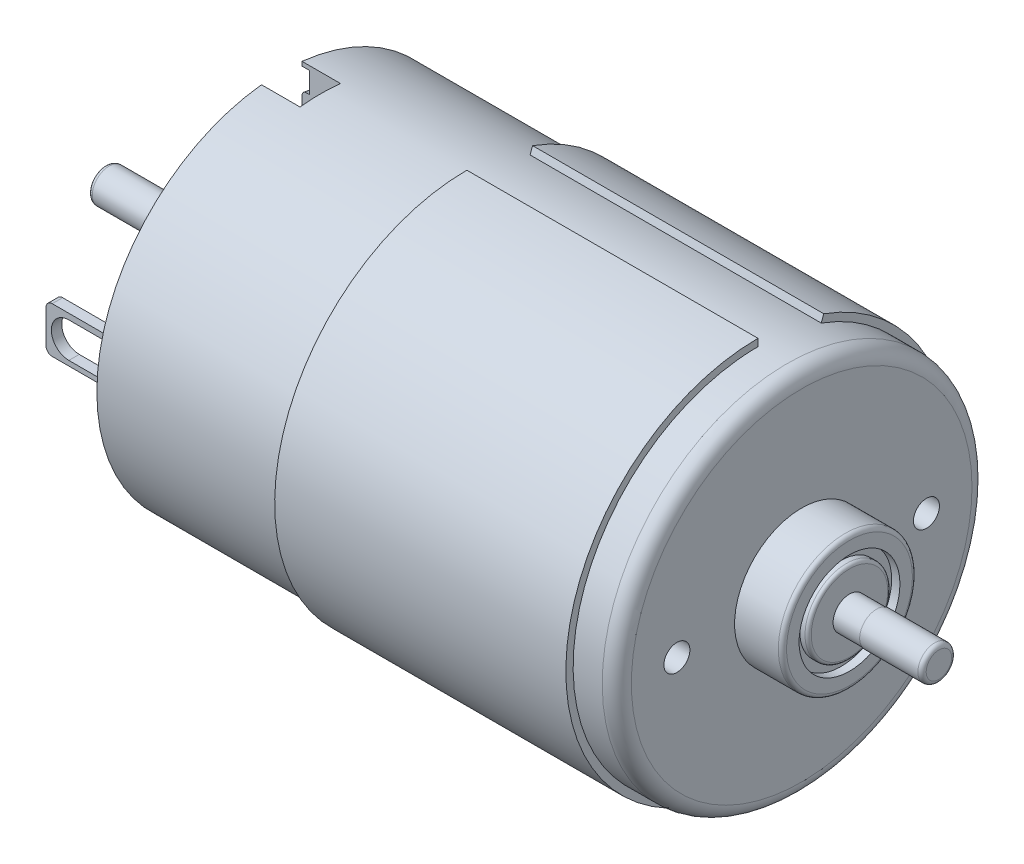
SolidWorks part; units mm, degrees
ref_plane "Front Plane" through (0, 0, 0) normal (0, 0, 1) x (1, 0, 0)
ref_plane "Top Plane" through (0, 0, 0) normal (0, 1, 0) x (1, 0, 0)
ref_plane "Right Plane" through (0, 0, 0) normal (1, 0, 0) x (0, 0, -1)
sketch "Sketch1" plane through (0, 0, 0) normal (1, 0, 0) x (0, 0, -1)
  circle A0 centre (0, 0) radius 17.78
extrude "Extrude1" add sketch "Sketch1" along normal blind 50
sketch "Sketch2" plane through (50, 0, 0) normal (1, 0, 0) x (0, 0, -1)
  circle A0 centre (0, 0) radius 6.45
extrude "Extrude2" add sketch "Sketch2" along normal blind 4.6
sketch "Sketch3" plane through (54.6, 0, 0) normal (1, 0, 0) x (0, 0, -1)
  circle A0 centre (0, 0) radius 1.58
extrude "Extrude3" add sketch "Sketch3" along normal blind 2.6
fillet "Fillet1" radius 1.4 1 edges at (50, 0, -17.78)
sketch "Sketch4" plane through (0, 0, 0) normal (-1, 0, 0) x (0, 0, 1)
  circle A0 centre (0, 0) radius 6.475
extrude "Extrude4" add sketch "Sketch4" along normal blind 3
sketch "Sketch5" plane through (-3, 0, 0) normal (-1, 0, 0) x (0, 0, 1)
  circle A0 centre (0, 0) radius 3.95
  circle A1 centre (0, 0) radius 2.9
extrude "Extrude5" add sketch "Sketch5" along normal blind 1
chamfer "Chamfer1" distance 0.8 angle 45 1 edges at (-4, 0, 3.95)
sketch "Sketch6" plane through (-3, 0, 0) normal (-1, 0, 0) x (0, 0, 1)
  circle A0 centre (0, 0) radius 1.58
extrude "Extrude6" add sketch "Sketch6" along normal blind 8
sketch "Sketch7" plane through (54.6, 0, 0) normal (1, 0, 0) x (0, 0, -1)
  circle A0 centre (0, 0) radius 4.85
  circle A1 centre (0, 0) radius 3.98
extrude "Extrude7" cut sketch "Sketch7" against normal blind 0.8
fillet "Fillet2" radius 0.3 1 edges at (54.6, 0, -3.98)
fillet "Fillet3" radius 0.4 1 edges at (54.6, 0, -6.45)
sketch "Sketch8" plane through (0, 0, 0) normal (-1, 0, 0) x (0, 0, 1)
  line L1 (0, 15.38) -> (0, -15.38) construction
  line L2 (-8.972, -12.4919) -> (8.972, -12.4919)
  line L3 (-8.972, -12.4919) -> (-8.972, 12.4919)
  line L4 (-8.972, 12.4919) -> (8.972, 12.4919)
  line L5 (8.972, -12.4919) -> (8.972, 12.4919)
  line L6 (-8.972, -12.4919) -> (8.972, 12.4919) construction
  line L7 (-8.972, 12.4919) -> (8.972, -12.4919) construction
  circle A0 centre (0, 0) radius 17.38
  circle A1 centre (0, 0) radius 15.38
  circle A2 centre (0, 0) radius 17.78 construction
  dimension "D1" = 17.9439
  dimension "D2" = 2
  dimension "D3" = 0.4
extrude "Extrude9" cut sketch "Sketch8" against normal blind 0.7 contours L3 A1 | A0 A1 | L5 A1
fillet "Fillet4" radius 0.4 5 edges at (0, 0, -6.475) (0, 0, 8.972) (0, 15.38, 0) (0, -15.38, 0) (0, 0, -8.972)
sketch "Sketch11" plane through (0, 0, 0) normal (-1, 0, 0) x (0, 0, 1)
  line L0 (0, -20.3904) -> (0, 28.4689) construction
  line L1 (-2.95, 19.0412) -> (2.95, 19.0412)
  line L2 (-2.95, 19.0412) -> (-2.95, 13.1401)
  line L3 (-2.95, 13.1401) -> (2.95, 13.1401)
  line L4 (2.95, 19.0412) -> (2.95, 13.1401)
  line L5 (-1.95, -13.7401) -> (1.95, -18.8623) construction
  line L6 (-21.1725, 0) -> (23.0165, 0) construction
  line L7 (-3.0332, -17.5194) -> (3.0332, -17.5194)
  line L8 (2.95, -19.0412) -> (2.95, -13.1401)
  line L9 (-2.95, -13.1401) -> (2.95, -13.1401)
  line L10 (-2.95, -19.0412) -> (-2.95, -13.1401)
  line L11 (-2.95, -19.0412) -> (2.95, -19.0412)
  line L12 (-1.95, 18.8623) -> (1.95, 18.8623)
  line L13 (-1.95, 18.8623) -> (-1.95, 13.7401)
  line L14 (-1.95, 13.7401) -> (1.95, 13.7401)
  line L15 (1.95, 18.8623) -> (1.95, 13.7401)
  line L16 (-1.95, 18.8623) -> (1.95, 13.7401) construction
  line L17 (-1.95, 13.7401) -> (1.95, 18.8623) construction
  line L18 (-1.95, -18.8623) -> (1.95, -13.7401) construction
  line L19 (0, 20.3904) -> (0, -28.4689) construction
  line L20 (1.95, -18.8623) -> (1.95, -13.7401)
  line L21 (-1.95, -13.7401) -> (1.95, -13.7401)
  line L22 (-1.95, -18.8623) -> (-1.95, -13.7401)
  line L23 (-1.95, -18.8623) -> (1.95, -18.8623)
  line L24 (2.95, -19.0412) -> (2.95, -13.1401)
  line L25 (-2.95, -13.1401) -> (2.95, -13.1401)
  line L26 (-2.95, -19.0412) -> (-2.95, -13.1401)
  line L27 (-2.95, -19.0412) -> (2.95, -19.0412)
  point P7 (0, 16.3012)
  point P27 (0, -16.3012)
  dimension "D1" = 5.9
  dimension "D2" = 2.95
  dimension "D3" = 1
  dimension "D4" = 0.6
extrude "Extrude11" cut sketch "Sketch11" against normal blind 3.7 contours L15 L12 L13 M4 | L15 L13 L14 M4 | L22 L7 L20 M2 | L22 L20 L21 M2 | L22 L23 L20 L7
sketch "Sketch13" plane through (0.7, 0, 0) normal (-1, 0, 0) x (0, 0, 1)
  line L0 (25.4225, 0) -> (-19.8791, 0) construction
  line L1 (11.2225, -5.97) -> (16.3225, -5.97)
  line L2 (11.2225, -5.97) -> (11.2225, 5.97)
  line L3 (11.2225, 5.97) -> (16.3225, 5.97)
  line L4 (16.3225, -5.97) -> (16.3225, 5.97)
  line L5 (11.2225, -5.97) -> (16.3225, 5.97) construction
  line L6 (11.2225, 5.97) -> (16.3225, -5.97) construction
  line L7 (11.9725, 5) -> (15.5725, 5)
  line L8 (11.9725, 5) -> (11.9725, -5)
  line L9 (11.9725, -5) -> (15.5725, -5)
  line L10 (15.5725, 5) -> (15.5725, -5)
  line L11 (11.9725, 5) -> (15.5725, -5) construction
  line L12 (11.9725, -5) -> (15.5725, 5) construction
  line L13 (0, 20.1635) -> (0, -20.37) construction
  line L14 (-11.9725, -5) -> (-15.5725, 5) construction
  line L15 (-11.9725, 5) -> (-15.5725, -5) construction
  line L16 (-11.2225, 5.97) -> (-16.3225, -5.97) construction
  line L17 (-11.2225, -5.97) -> (-16.3225, 5.97) construction
  line L18 (-15.5725, 5) -> (-15.5725, -5)
  line L19 (-11.9725, -5) -> (-15.5725, -5)
  line L20 (-11.9725, 5) -> (-11.9725, -5)
  line L21 (-11.9725, 5) -> (-15.5725, 5)
  line L22 (-16.3225, -5.97) -> (-16.3225, 5.97)
  line L23 (-11.2225, 5.97) -> (-16.3225, 5.97)
  line L24 (-11.2225, -5.97) -> (-11.2225, 5.97)
  line L25 (-11.2225, -5.97) -> (-16.3225, -5.97)
  arc A0 (1.95, -17.2703) -> (1.95, 17.2703) centre (0, 0) ccw construction
  arc A1 (16.3225, 5.97) -> (17.38, 0) centre (0, 0) ccw
  arc A2 (-16.3225, 5.97) -> (-17.38, 0) centre (0, 0) cw
  point P0 (13.7725, 0)
  point P8 (13.7725, 0)
  point P18 (24.7787, 5)
  point P21 (16.3225, -5.97)
  point P31 (-13.7725, 0)
  dimension "D1" = 5.1
  dimension "D2" = 3.6
  dimension "D3" = 10
  dimension "D4" = 11.94
  dimension "D5" = 0
extrude "Extrude12" add sketch "Sketch13" along normal blind 0.7 contours L4 M2 | L1 L4 L3 L2 L7 L10 L9 L8 | L25 L24 L23 L22 L21 L20 L19 L18 | L22 A1
sketch "Sketch14" plane through (0.7, 0, 0) normal (-1, 0, 0) x (0, 0, 1)
  line L0 (-24.3673, 0) -> (35.6636, 0) construction
  line L1 (13.7725, 2.2) -> (14.7725, 2.2)
  line L2 (13.7725, 2.2) -> (13.7725, -2.2)
  line L3 (13.7725, -2.2) -> (14.7725, -2.2)
  line L4 (14.7725, 2.2) -> (14.7725, -2.2)
  line L5 (13.7725, 2.2) -> (14.7725, -2.2) construction
  line L6 (13.7725, -2.2) -> (14.7725, 2.2) construction
  line L7 (15.5725, 5) -> (15.5725, -5) construction
  line L8 (0, 24.6078) -> (0, -24.5764) construction
  line L9 (-13.7725, -2.2) -> (-14.7725, 2.2) construction
  line L10 (-13.7725, 2.2) -> (-14.7725, -2.2) construction
  line L11 (-14.7725, 2.2) -> (-14.7725, -2.2)
  line L12 (-13.7725, -2.2) -> (-14.7725, -2.2)
  line L13 (-13.7725, 2.2) -> (-13.7725, -2.2)
  line L14 (-13.7725, 2.2) -> (-14.7725, 2.2)
  point P0 (14.2725, 0)
  point P16 (-14.2725, 0)
  dimension "D1" = 1
  dimension "D2" = 4.4
  dimension "D3" = 0
  dimension "D4" = 0.8
extrude "Extrude13" add sketch "Sketch14" along normal blind 8.6
fillet "Fillet5" radius 0.6 4 edges at (-7.9, -2.2, -14.2725) (-7.9, 2.2, -14.2725) (-7.9, -2.2, 14.2725) (-7.9, 2.2, 14.2725)
sketch "Sketch15" plane through (0, 0, -14.7725) normal (0, 0, -1) x (-1, 0, 0)
  line L0 (-3.3897, 0) -> (11.6139, 0) construction
  line L1 (5.7, 0) -> (2.7, 0) construction
  line L2 (5.7, -1.6846) -> (2.7, -1.6846)
  line L3 (5.7, 1.6846) -> (2.7, 1.6846)
  line L4 (0, -17.6727) -> (0, 17.6727) construction
  arc A0 (5.7, -1.6846) -> (5.7, 1.6846) centre (5.7, 0) ccw
  arc A1 (2.7, 1.6846) -> (2.7, -1.6846) centre (2.7, 0) ccw
  point P5 (4.2, 0)
  dimension "D1" = 3
  dimension "D2" = 4.2
sketch "Sketch17" plane through (50, 0, 0) normal (1, 0, 0) x (0, 0, -1)
  line L0 (-21.6095, 0) -> (22.9353, 0) construction
  line L1 (0, 19.0906) -> (0, -19.8861) construction
  circle A0 centre (12, 0) radius 1.25
  circle A2 centre (-12, 0) radius 1.25
  dimension "D1" = 12
extrude "Extrude16" cut sketch "Sketch17" against normal blind 5.8 contours A2 | A0
sketch "Sketch18" plane through (-11, 0, 0) normal (-1, 0, 0) x (0, 0, 1)
  circle A0 centre (0, 0) radius 1.625
extrude "Extrude17" add sketch "Sketch18" along normal blind 6
sketch "Sketch19" plane through (57.2, 0, 0) normal (1, 0, 0) x (0, 0, -1)
  circle A0 centre (0, 0) radius 1.625
extrude "Extrude18" add sketch "Sketch19" along normal blind 6
fillet "Fillet6" radius 0.4 1 edges at (63.2, 0, -1.625)
fillet "Fillet7" radius 0.4 1 edges at (-17, 0, 1.625)
sketch "Sketch21" plane through (0, 0, 0) normal (0, 0, 1) x (1, 0, 0)
  line L0 (-19.3307, 0) -> (70.1243, 0) construction
  line L1 (48.6, 17.78) -> (3.7, 17.78) construction
  line L2 (17.8, 17.78) -> (45.8, 17.78)
  line L3 (17.8, 17.78) -> (17.8, 18.48)
  line L4 (17.8, 18.48) -> (45.8, 18.48)
  line L5 (45.8, 17.78) -> (45.8, 18.48)
  line L6 (50, -16.38) -> (50, 16.38) construction
  dimension "D1" = 0.7
  dimension "D2" = 28
  dimension "D3" = 4.2
revolve "Revolve1" add sketch "Sketch21" angle 340 about L0
sketch "Sketch22" plane through (0, 0, 14.7725) normal (0, 0, 1) x (1, 0, 0)
  line L0 (-8.2216, -0.0401) -> (6.782, -0.0401) construction
  line L1 (-2.7, -0.0401) -> (-5.7, -0.0401) construction
  line L2 (-2.7, -1.7248) -> (-5.7, -1.7248)
  line L3 (-2.7, 1.6445) -> (-5.7, 1.6445)
  line L4 (0, 17.6727) -> (0, -17.6727) construction
  arc A0 (-2.7, -1.7248) -> (-2.7, 1.6445) centre (-2.7, -0.0401) ccw
  arc A1 (-5.7, 1.6445) -> (-5.7, -1.7248) centre (-5.7, -0.0401) ccw
  point P5 (-4.2, -0.0401)
  dimension "D1" = 3
  dimension "D2" = 4.2
extrude "Extrude20" cut sketch "Sketch15" against normal blind 1
extrude "Extrude21" cut sketch "Sketch22" against normal blind 1
